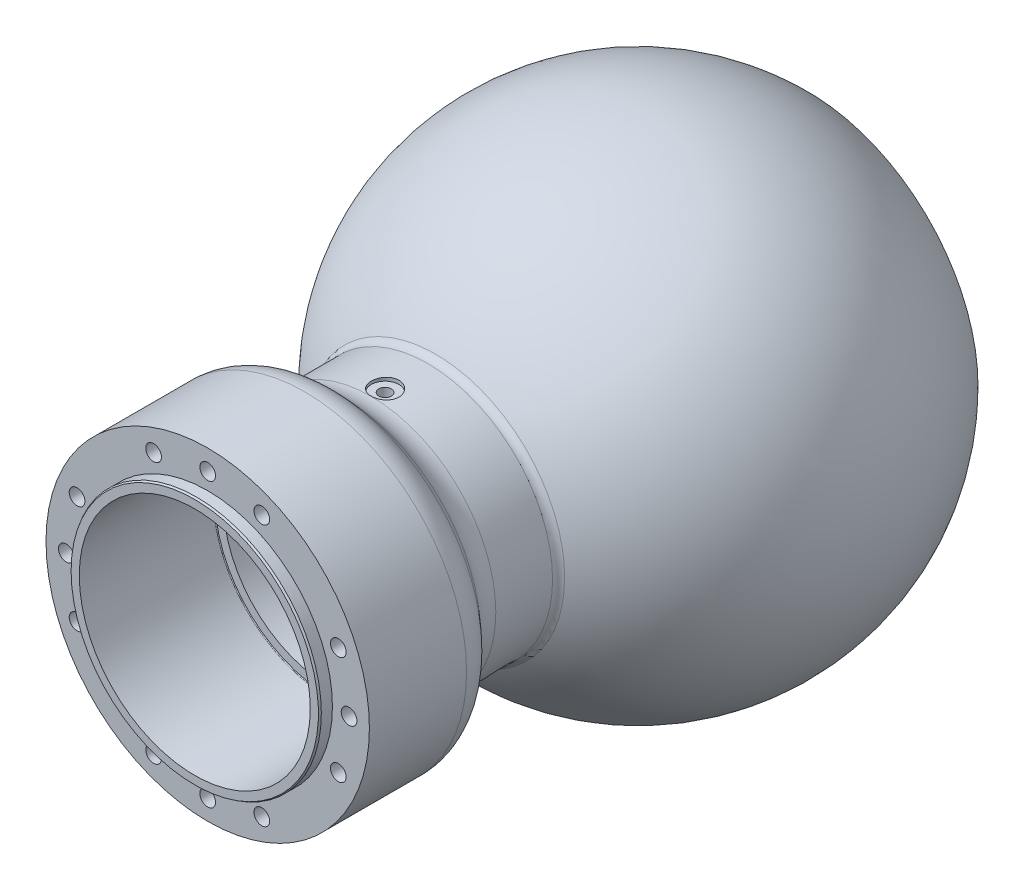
SolidWorks part; units mm, degrees
ref_plane "Plan de face" through (0, 0, 0) normal (0, 0, 1) x (1, 0, 0)
ref_plane "Plan de dessus" through (0, 0, 0) normal (0, 1, 0) x (1, 0, 0)
ref_plane "Plan de droite" through (0, 0, 0) normal (1, 0, 0) x (0, 0, -1)
sketch "Esquisse1" plane through (0, 0, 0) normal (1, 0, 0) x (0, 0, -1)
  line L0 (0, 0) -> (351.467, 0) construction
  line L1 (0, 29.4207) -> (0, -81.608) construction
  line L2 (0, 62.5) -> (72.6, 62.5)
  line L3 (73, 62.1) -> (73, 57.5)
  line L4 (73, 57.5) -> (134.6753, 57.5)
  line L5 (0, 62.5) -> (0, 67.5)
  line L6 (0, 67.5) -> (7, 67.5)
  line L7 (7, 67.5) -> (7, 87.5)
  line L8 (7, 87.5) -> (59.5928, 87.5)
  line L9 (74.4586, 80.8793) -> (80.5414, 74.1207)
  line L10 (95.4072, 67.5) -> (128.9, 67.5)
  line L11 (319.368, 90) -> (332, 90)
  line L12 (332, 91.8437) -> (332, 90)
  arc A0 (73, 62.1) -> (72.6, 62.5) centre (72.6, 62.1) ccw
  arc A1 (74.4586, 80.8793) -> (59.5928, 87.5) centre (59.5928, 67.5) ccw
  arc A2 (95.4072, 67.5) -> (80.5414, 74.1207) centre (95.4072, 87.5) cw
  arc A3 (128.9, 67.5) -> (332, 91.8437) centre (240, -0.004) cw
  arc A4 (134.6753, 57.5) -> (319.368, 90) centre (240, -0.004) cw
  point P19 (68.5, 87.5)
  point P22 (86.5, 67.5)
  dimension "D5" = 68.5
  dimension "D6" = 86.5
  dimension "D8" = 0.4
  dimension "D9" = 20
  dimension "D13" = 130
  dimension "D16" = 120
  dimension "D1" = 125
  dimension "D2" = 115
  dimension "D3" = 135
  dimension "D4" = 175
  dimension "D7" = 135
  dimension "D10" = 128.9
  dimension "D11" = 73
  dimension "D12" = 7
  dimension "D14" = 332
  dimension "D15" = 240
  dimension "D17" = 180
revolve "Révolution1" add sketch "Esquisse1" angle 360 about L0
fillet "Congé1" radius 5 2 edges at (67.5, 0, -128.9) (57.5, 0, -134.6753)
sketch "Esquisse2" plane through (0, 0, -7) normal (0, 0, 1) x (1, 0, 0)
  line L0 (0, 110.6337) -> (0, -144.7306) construction
  line L1 (0, 0) -> (-40.0606, 96.7148) construction
  circle A0 centre (0, 0) radius 76.5 construction
  dimension "D1" = 153
  dimension "D2" = 22.5
hole_wizard "Trou taraudé M101" positions "Esquisse3D1" profile "Esquisse3" tap size "M10" standard "ISO"
sketch3d "Esquisse3D1"
  line L1 (0, 0, -7) -> (-40.0606, 96.7148, -7) construction
  circle A0 centre (0, 0, -7) radius 76.5 construction
  point P6 (0, 0, 69.5)
  point P8 (-29.2753, 70.6768, -7)
sketch "Esquisse3" plane through (-29.2753, 70.6768, -7) normal (1, 0, 0) x (0, -1, 0)
  line L0 (0, 0) -> (0, 27.5537)
  line L1 (0, 27.5537) -> (4.25, 25)
  line L2 (4.25, 25) -> (4.25, 0)
  line L5 (4.25, 0) -> (0, 0)
  line L10 (0, 27.5537) -> (-4.25, 25) construction
  line L11 (0, -6.35) -> (0, 107.95) construction
  dimension "Diamètre du trou pour taraudage" = 8.5
  dimension "Profondeur du trou pour taraudage" = 25
  dimension "Angle de pointe" = 118
pattern_circular "Répétition circulaire1" count 3 every 22.5 about axis through (0, 0, 0) along (0, 0, 1) of "Trou taraudé M101"
pattern_circular "Répétition circulaire2" count 4 every 90 about axis through (0, 0, 0) along (0, 0, 1) of "Répétition circulaire1", "Trou taraudé M101"
ref_plane "Plan1" through (0, 87.5, 0) normal (0, 1, 0) x (-1, 0, 0)
ref_plane "Plan2" through (0, 67.5, 0) normal (0, 1, 0) x (-1, 0, 0)
sketch "Esquisse8" plane through (0, 67.5, 0) normal (0, 1, 0) x (-1, 0, 0)
  line L0 (87.5, -7) -> (-87.5, -7) construction
  circle A0 centre (0, -103) radius 7.5
  dimension "D2" = 15
  dimension "D1" = 96
extrude "Extrusion3" cut sketch "Esquisse8" against normal blind 2
hole_wizard "Trou taraudé M81" positions "Esquisse3D3" profile "Esquisse10" tap size "M8" standard "ISO"
sketch3d "Esquisse3D3"
  line L0 (0, 65.5, -103) -> (0, 67.5, -103) construction
  point P0 (0, 65.5, -103)
sketch "Esquisse10" plane through (0, 65.5, -103) normal (1, 0, 0) x (0, 0, 1)
  line L0 (0, 0) -> (0, 32.0429)
  line L1 (0, 32.0429) -> (3.4, 30)
  line L2 (3.4, 30) -> (3.4, 0)
  line L5 (3.4, 0) -> (0, 0)
  line L10 (0, 32.0429) -> (-3.4, 30) construction
  line L11 (0, -6.35) -> (0, 107.95) construction
  dimension "Diamètre du trou pour taraudage" = 6.8
  dimension "Profondeur du trou pour taraudage" = 30
  dimension "Angle de pointe" = 118
ref_plane "Plan3" through (0, 0, 0) normal (-0.7071, -0.7071, 0) x (0.7071, -0.7071, 0)
ref_plane "Plan4" through (-47.7297, -47.7297, 0) normal (-0.7071, -0.7071, 0) x (0.7071, -0.7071, 0)
sketch "Esquisse11" plane through (-47.7297, -47.7297, 0) normal (-0.7071, -0.7071, 0) x (0.7071, -0.7071, 0)
  line L0 (0, -107.9554) -> (0, -1.8891) construction
  line L1 (0, -131.7491) -> (0, -73) construction
  line L2 (67.5, -7) -> (-67.5, -7) construction
  circle A0 centre (0, -116) radius 7.5
  dimension "D1" = 15
  dimension "D2" = 109
extrude "Extrusion4" cut sketch "Esquisse11" against normal blind 2
hole_wizard "Trou taraudé M82" positions "Esquisse13" profile "Esquisse12" tap size "M8" standard "ISO"
sketch "Esquisse13" plane through (-46.3155, -46.3155, 0) normal (-0.7071, -0.7071, 0) x (0.7071, -0.7071, 0)
  point P1 (0, -116)
sketch "Esquisse12" plane through (-46.3155, -46.3155, -116) normal (0, 0, 1) x (0.7071, -0.7071, 0)
  line L0 (0, 0) -> (0, 32.0429)
  line L1 (0, 32.0429) -> (3.4, 30)
  line L2 (3.4, 30) -> (3.4, 0)
  line L5 (3.4, 0) -> (0, 0)
  line L10 (0, 32.0429) -> (-3.4, 30) construction
  line L11 (0, -6.35) -> (0, 107.95) construction
  dimension "Diamètre du trou pour taraudage" = 6.8
  dimension "Profondeur du trou pour taraudage" = 30
  dimension "Angle de pointe" = 118
pattern_circular "Répétition circulaire3" count 2 every 90 about axis through (0, 0, 0) along (0, 0, 1) of "Trou taraudé M82", "Extrusion4"
chamfer "Chanfrein1" distance 1 angle 30 1 edges at (67.5, 0, 0)
sketch "Esquisse14" plane through (0, 0, 0) normal (0, 1, 0) x (1, 0, 0)
  line L0 (-129.996, 240) -> (129.996, 240) construction
  line L1 (0, 0) -> (0, 352.5007) construction
  arc A0 (-91.8437, 332) -> (-69.8147, 130.3398) centre (0.004, 240) ccw construction
  arc A1 (69.8147, 130.3398) -> (91.8437, 332) centre (-0.004, 240) ccw construction
sketch "Esquisse15" plane through (0, 0, 0) normal (1, 0, 0) x (0, 0, -1)
  line L0 (240, 129.996) -> (240, -129.996) construction
  arc A0 (332, 91.8437) -> (130.3398, 69.8147) centre (240, -0.004) ccw construction
  arc A1 (130.3398, -69.8147) -> (332, -91.8437) centre (240, 0.004) ccw construction
  point P8 (240, 0)
